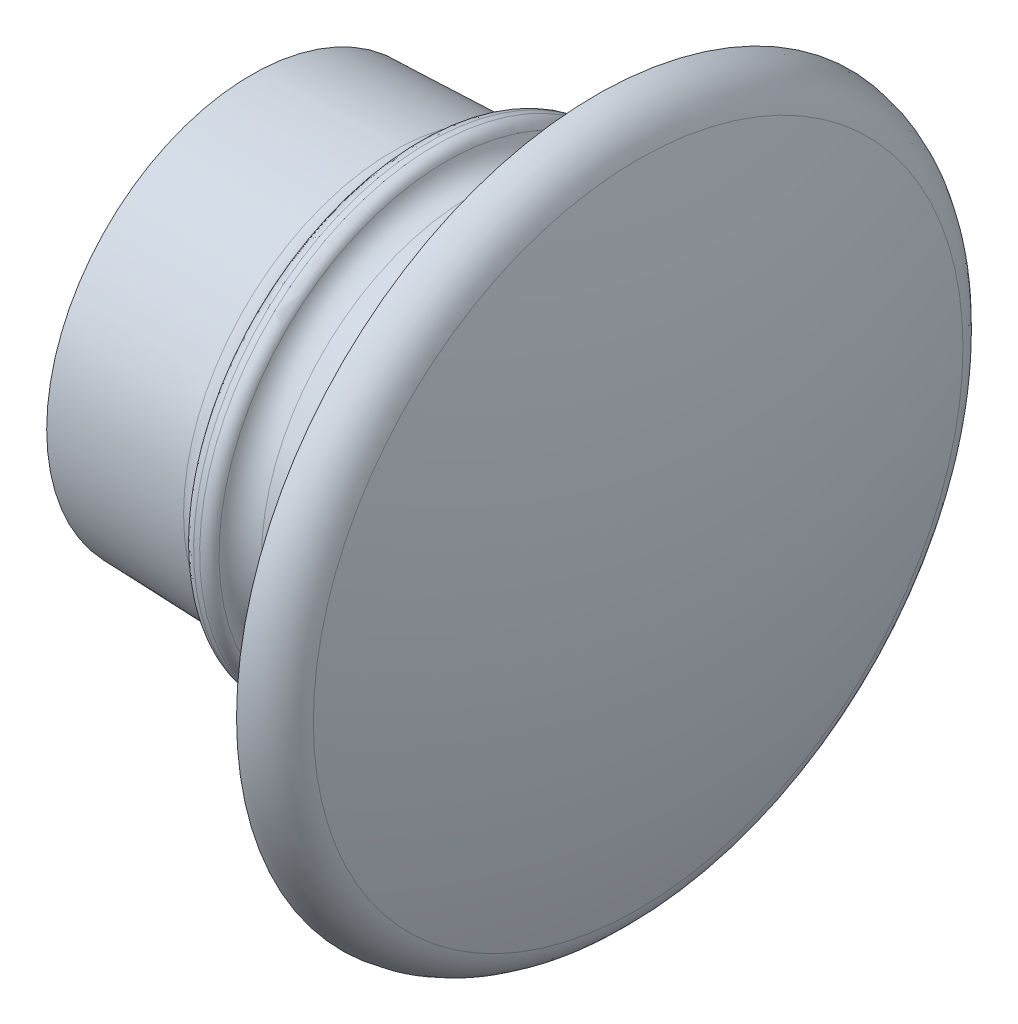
SolidWorks part; units mm, degrees
ref_plane "Plan1" through (0, 0, 0) normal (0, 0, 1) x (1, 0, 0)
ref_plane "Plan2" through (0, 0, 0) normal (0, 1, 0) x (1, 0, 0)
ref_plane "Plan3" through (0, 0, 0) normal (1, 0, 0) x (0, 0, -1)
sketch "Esquisse1" plane through (0, 0, 0) normal (1, 0, 0) x (0, 0, -1)
  circle A0 centre (0, 0) radius 8.75
  dimension "D1" = 17.5
extrude "Base-Extrusion" add sketch "Esquisse1" along normal blind 14
sketch "Esquisse7"
  line L0 (0, 0) -> (30, 0) construction
  line L1 (14.3759, 15) -> (15.697, 15)
  line L2 (14.3759, 15) -> (14.3759, 12.2903)
  line L3 (18, 0) -> (14, 0)
  line L5 (14.4584, 11.7217) -> (14.9587, 10.0343)
  line L6 (14, 8.75) -> (0, 8.75) construction
  line L7 (14, 8.75) -> (14, 0)
  line L8 (14, 0) -> (0, 0) construction
  arc A0 (15.697, 15) -> (18, 0) centre (-32, 0) cw
  arc A1 (14.9587, 10.0343) -> (14, 8.75) centre (14, 9.75) cw
  arc A2 (14.4584, 11.7217) -> (14.3759, 12.2903) centre (16.3759, 12.2903) cw
  point P18 (14.3759, 12)
revolve "Boss.-Révol.1" add sketch "Esquisse5"
sketch "Esquisse5"
  line L0 (-2.7996, 0) -> (20, 0) construction
  line L2 (-1.3, 0) -> (-1.5, 0) construction
  line L3 (9.1835, 8.75) -> (9.1835, 0)
  line L4 (7.6617, 9.8256) -> (7.4117, 9.8256)
  line L5 (9.1835, 0) -> (5.8835, 0)
  line L6 (5.8835, 0) -> (5.8835, 8.75)
  line L8 (0, 8.75) -> (0, -8.75) construction
  line L10 (14.3759, 15) -> (14.3759, -15) construction
  arc A0 (6.9393, 9.4894) -> (7.4117, 9.8256) centre (7.4117, 9.3256) cw
  arc A2 (7.6617, 9.8256) -> (8.1341, 9.4894) centre (7.6617, 9.3256) cw
  arc A3 (6.9393, 9.4894) -> (5.8835, 8.75) centre (5.9, 9.8499) cw
  arc A4 (9.1835, 8.75) -> (8.1341, 9.4894) centre (9.1734, 9.85) cw
revolve "Boss.-Révol.2" add sketch "Esquisse7" angle 360 about L0
sketch "Esquisse6" plane through (0, 0, 0) normal (0, 1, 0) x (1, 0, 0)
  line L0 (0, 0) -> (-17.5, 0) construction
  line L1 (14.3759, 15) -> (14.3759, -15) construction
  line L3 (16.3759, 0) -> (0, 0)
  line L4 (0, 7.25) -> (15.8707, 6.973)
  line L6 (0, 8.75) -> (0, -8.75) construction
  line L8 (5.9165, 0) -> (0, 0) construction
  line L9 (0, 7.25) -> (0, 0)
  arc A0 (15.8707, 6.973) -> (16.3759, 0) centre (-32, 0) cw
  arc A1 (15.697, -15) -> (15.697, 15) centre (-32, 0) ccw construction
  dimension "D1" = 2
  dimension "D2" = 14.5
  dimension "D3" = 1
revolve "Enlèvement de matière-Révolution1" cut sketch "Esquisse6" angle 360 about L0
fillet "Congé11" radius 2
sketch "Esquisse8" plane through (0, 0, 0) normal (0, 0, 1) x (1, 0, 0)
  line L0 (0, 0) -> (15.0133, 0) construction
  line L1 (5.9165, 0) -> (0, 0) construction
  line L2 (5.9165, 8.75) -> (5.9165, 11.2897)
  line L4 (5.9165, 11.2897) -> (0, 11.2897)
  line L5 (5.9165, -8.75) -> (5.9165, 8.75) construction
  line L6 (0, 11.2897) -> (0, 8.5434)
  line L7 (0, 8.75) -> (0, -8.75) construction
  line L8 (5.9165, 8.75) -> (0, 8.75) construction
  line L9 (0, 8.5434) -> (5.9165, 8.75)
  dimension "D1" = 2
revolve "Enlèvement de matière-Révolution2" cut sketch "Esquisse8" angle 360 about L0
fillet "Congé13" radius 2
